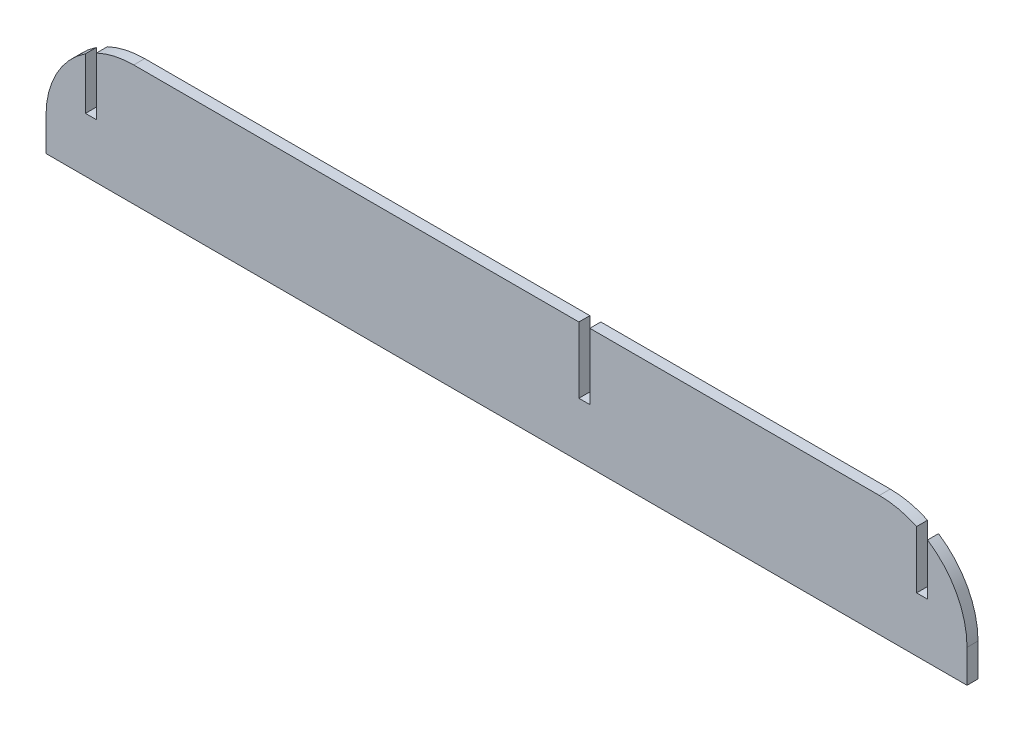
SolidWorks part; units mm, degrees
ref_plane "Alzado" through (0, 0, 0) normal (0, 0, 1) x (1, 0, 0)
ref_plane "Planta" through (0, 0, 0) normal (0, 1, 0) x (1, 0, 0)
ref_plane "Vista lateral" through (0, 0, 0) normal (1, 0, 0) x (0, 0, -1)
sketch "Croquis1" plane through (0, 0, 0) normal (0, 0, 1) x (1, 0, 0)
  line L1 (-210, 0) -> (210, 0)
  line L2 (-210, 0) -> (-210, 55)
  line L3 (-210, 55) -> (210, 55)
  line L4 (210, 0) -> (210, 55)
  dimension "D1" = 55
  dimension "D2" = 420
extrude "Saliente-Extruir1" add sketch "Croquis1" along normal blind 5
fillet "Redondeo1" radius 40 2 edges at (210, 55, 2.5) (-210, 55, 2.5)
sketch "Croquis2" plane through (0, 0, 0) normal (0, 0, -1) x (-1, 0, 0)
  line L0 (187, 55) -> (187, 25) construction
  line L3 (187, 0) -> (192, 0)
  line L5 (210, 0) -> (-210, 0) construction
  line L6 (192, 0) -> (192, 25) construction
  line L7 (-38, 0) -> (-38, 110) construction
  line L8 (-38, 55) -> (-33, 55)
  line L9 (-38, 55) -> (-38, 24.8636)
  line L10 (-38, 24.8636) -> (-33, 24.8636)
  line L11 (-33, 55) -> (-33, 24.8636)
  line L12 (-33, 0) -> (-33, 110) construction
  line L13 (192.5, 24.8636) -> (-192.5, 24.8636) construction
  line L14 (192, 25) -> (192, 55) construction
  line L15 (187, 55) -> (192, 55)
  line L16 (187, 55) -> (187, 24.8636)
  line L17 (187, 24.8636) -> (192, 24.8636)
  line L18 (192, 55) -> (192, 24.8636)
  line L19 (-187, 25) -> (-187, 55) construction
  line L20 (-192, 55) -> (-187, 55)
  line L21 (-192, 55) -> (-192, 25)
  line L22 (-192, 25) -> (-187, 25)
  line L23 (-187, 55) -> (-187, 25)
  dimension "D1" = 25
extrude "Cortar-Extruir1" cut sketch "Croquis2" against normal through all contours L23 L21 L22 M5 | L23 L20 L21 M5 | L11 L9 L10 M4 | L18 L15 L16 M9 | L18 L16 L17 M9
